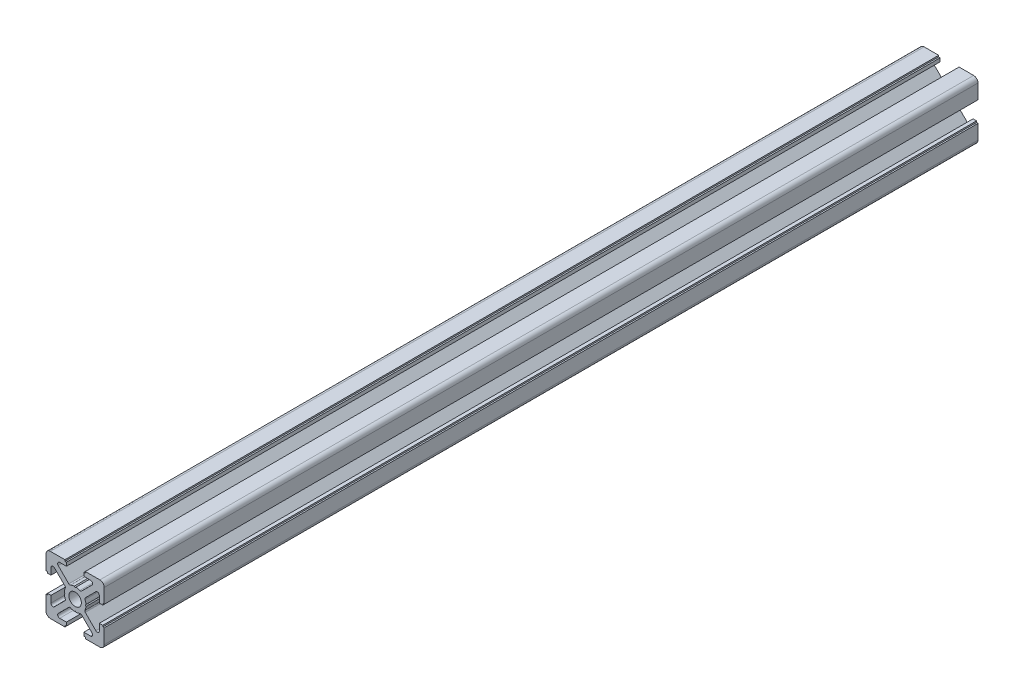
SolidWorks part; units mm, degrees
ref_plane "Front Plane" through (0, 0, 0) normal (0, 0, 1) x (1, 0, 0)
ref_plane "Top Plane" through (0, 0, 0) normal (0, 1, 0) x (1, 0, 0)
ref_plane "Right Plane" through (0, 0, 0) normal (1, 0, 0) x (0, 0, -1)
ref_plane "Plane1" through (0, 0, 308) normal (0, 0, 1) x (1, 0, 0)
sketch "Sketch1" plane through (0, 0, 308) normal (0, 0, 1) x (1, 0, 0)
  line L0 (-3.5, -10) -> (-3.5, -9.5)
  line L1 (-3.5, -9.5) -> (-3, -9.5)
  line L2 (-3, -9.5) -> (-3, -8.3)
  line L3 (-3, -8.3) -> (-5.2994, -8.3)
  line L4 (-5.7944, -7.105) -> (-2.1755, -3.4861)
  line L5 (-0.3, -3.738) -> (0, -3.45)
  line L6 (0, -3.45) -> (0.3, -3.738)
  line L7 (2.1755, -3.4861) -> (5.7944, -7.105)
  line L8 (5.2994, -8.3) -> (3, -8.3)
  line L9 (3, -8.3) -> (3, -9.5)
  line L10 (3, -9.5) -> (3.5, -9.5)
  line L11 (3.5, -9.5) -> (3.5, -10)
  line L12 (3.5, -10) -> (8.5, -10)
  line L13 (10, -8.5) -> (10, -3.5)
  line L14 (10, -3.5) -> (9.5, -3.5)
  line L15 (9.5, -3.5) -> (9.5, -3)
  line L16 (9.5, -3) -> (8.3, -3)
  line L17 (8.3, -3) -> (8.3, -5.2994)
  line L18 (7.105, -5.7944) -> (3.4861, -2.1755)
  line L19 (3.738, -0.3) -> (3.45, 0)
  line L20 (3.45, 0) -> (3.738, 0.3)
  line L21 (3.4861, 2.1755) -> (7.105, 5.7944)
  line L22 (8.3, 5.2994) -> (8.3, 3)
  line L23 (8.3, 3) -> (9.5, 3)
  line L24 (9.5, 3) -> (9.5, 3.5)
  line L25 (9.5, 3.5) -> (10, 3.5)
  line L26 (10, 3.5) -> (10, 8.5)
  line L27 (8.5, 10) -> (3.5, 10)
  line L28 (3.5, 10) -> (3.5, 9.5)
  line L29 (3.5, 9.5) -> (3, 9.5)
  line L30 (3, 9.5) -> (3, 8.3)
  line L31 (3, 8.3) -> (5.2994, 8.3)
  line L32 (5.7944, 7.105) -> (2.1755, 3.4861)
  line L33 (0.3, 3.738) -> (0, 3.45)
  line L34 (0, 3.45) -> (-0.3, 3.738)
  line L35 (-2.1755, 3.4861) -> (-5.7944, 7.105)
  line L36 (-5.2994, 8.3) -> (-3, 8.3)
  line L37 (-3, 8.3) -> (-3, 9.5)
  line L38 (-3, 9.5) -> (-3.5, 9.5)
  line L39 (-3.5, 9.5) -> (-3.5, 10)
  line L40 (-3.5, 10) -> (-8.5, 10)
  line L41 (-10, 8.5) -> (-10, 3.5)
  line L42 (-10, 3.5) -> (-9.5, 3.5)
  line L43 (-9.5, 3.5) -> (-9.5, 3)
  line L44 (-9.5, 3) -> (-8.3, 3)
  line L45 (-8.3, 3) -> (-8.3, 5.2994)
  line L46 (-7.105, 5.7944) -> (-3.4861, 2.1755)
  line L47 (-3.738, 0.3) -> (-3.45, 0)
  line L48 (-3.45, 0) -> (-3.738, -0.3)
  line L49 (-3.4861, -2.1755) -> (-7.105, -5.7944)
  line L50 (-8.3, -5.2994) -> (-8.3, -3)
  line L51 (-8.3, -3) -> (-9.5, -3)
  line L52 (-9.5, -3) -> (-9.5, -3.5)
  line L53 (-9.5, -3.5) -> (-10, -3.5)
  line L54 (-10, -3.5) -> (-10, -8.5)
  line L55 (-8.5, -10) -> (-3.5, -10)
  circle A0 centre (0, 0) radius 2.15
  arc A1 (-5.2994, -8.3) -> (-5.7944, -7.105) centre (-5.2994, -7.6) cw
  arc A2 (-2.1755, -3.4861) -> (-1.6076, -3.388) centre (-1.8219, -3.8397) cw
  arc A3 (-1.6076, -3.388) -> (-0.3, -3.738) centre (0, 0) ccw
  arc A4 (0.3, -3.738) -> (1.6076, -3.388) centre (0, 0) ccw
  arc A5 (1.6076, -3.388) -> (2.1755, -3.4861) centre (1.8219, -3.8397) cw
  arc A6 (5.7944, -7.105) -> (5.2994, -8.3) centre (5.2994, -7.6) cw
  arc A7 (8.5, -10) -> (10, -8.5) centre (8.5, -8.5) ccw
  arc A8 (8.3, -5.2994) -> (7.105, -5.7944) centre (7.6, -5.2994) cw
  arc A9 (3.4861, -2.1755) -> (3.388, -1.6076) centre (3.8397, -1.8219) cw
  arc A10 (3.388, -1.6076) -> (3.738, -0.3) centre (0, 0) ccw
  arc A11 (3.738, 0.3) -> (3.388, 1.6076) centre (0, 0) ccw
  arc A12 (3.388, 1.6076) -> (3.4861, 2.1755) centre (3.8397, 1.8219) cw
  arc A13 (7.105, 5.7944) -> (8.3, 5.2994) centre (7.6, 5.2994) cw
  arc A14 (10, 8.5) -> (8.5, 10) centre (8.5, 8.5) ccw
  arc A15 (5.2994, 8.3) -> (5.7944, 7.105) centre (5.2994, 7.6) cw
  arc A16 (2.1755, 3.4861) -> (1.6076, 3.388) centre (1.8219, 3.8397) cw
  arc A17 (1.6076, 3.388) -> (0.3, 3.738) centre (0, 0) ccw
  arc A18 (-0.3, 3.738) -> (-1.6076, 3.388) centre (0, 0) ccw
  arc A19 (-1.6076, 3.388) -> (-2.1755, 3.4861) centre (-1.8219, 3.8397) cw
  arc A20 (-5.7944, 7.105) -> (-5.2994, 8.3) centre (-5.2994, 7.6) cw
  arc A21 (-8.5, 10) -> (-10, 8.5) centre (-8.5, 8.5) ccw
  arc A22 (-8.3, 5.2994) -> (-7.105, 5.7944) centre (-7.6, 5.2994) cw
  arc A23 (-3.4861, 2.1755) -> (-3.388, 1.6076) centre (-3.8397, 1.8219) cw
  arc A24 (-3.388, 1.6076) -> (-3.738, 0.3) centre (0, 0) ccw
  arc A25 (-3.738, -0.3) -> (-3.388, -1.6076) centre (0, 0) ccw
  arc A26 (-3.388, -1.6076) -> (-3.4861, -2.1755) centre (-3.8397, -1.8219) cw
  arc A27 (-7.105, -5.7944) -> (-8.3, -5.2994) centre (-7.6, -5.2994) cw
  arc A28 (-10, -8.5) -> (-8.5, -10) centre (-8.5, -8.5) ccw
extrude "Boss-Extrude1" add sketch "Sketch1" against normal blind 300
